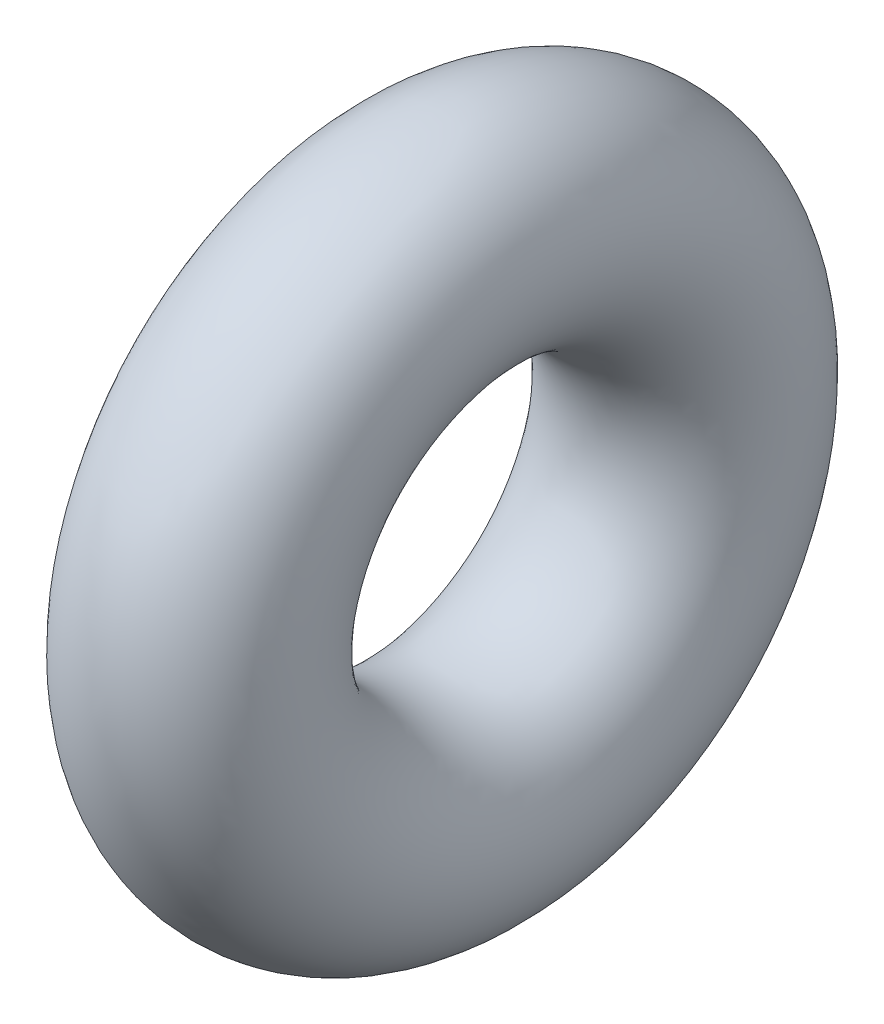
SolidWorks part; units mm, degrees
ref_plane "Face" through (0, 0, 0) normal (0, 0, 1) x (1, 0, 0)
ref_plane "Dessus" through (0, 0, 0) normal (0, 1, 0) x (1, 0, 0)
ref_plane "Droite" through (0, 0, 0) normal (1, 0, 0) x (0, 0, -1)
sketch "Esquisse1" plane through (0, 0, 0) normal (0, 0, 1) x (1, 0, 0)
  line L0 (3.2, 0.75) -> (2, 0.75) construction
  line L1 (3.2, 1.5) -> (3.2, -1.5) construction
  line L2 (2, -1.5) -> (2, 1.5) construction
  line L3 (0, 0) -> (3.4464, 0) construction
  line L4 (-1.6106, 0) -> (16.7924, 0) construction
  circle A0 centre (2.6, 1.35) radius 0.6
revolve "Base-Révolution" add sketch "Esquisse1" angle 360 about L3
